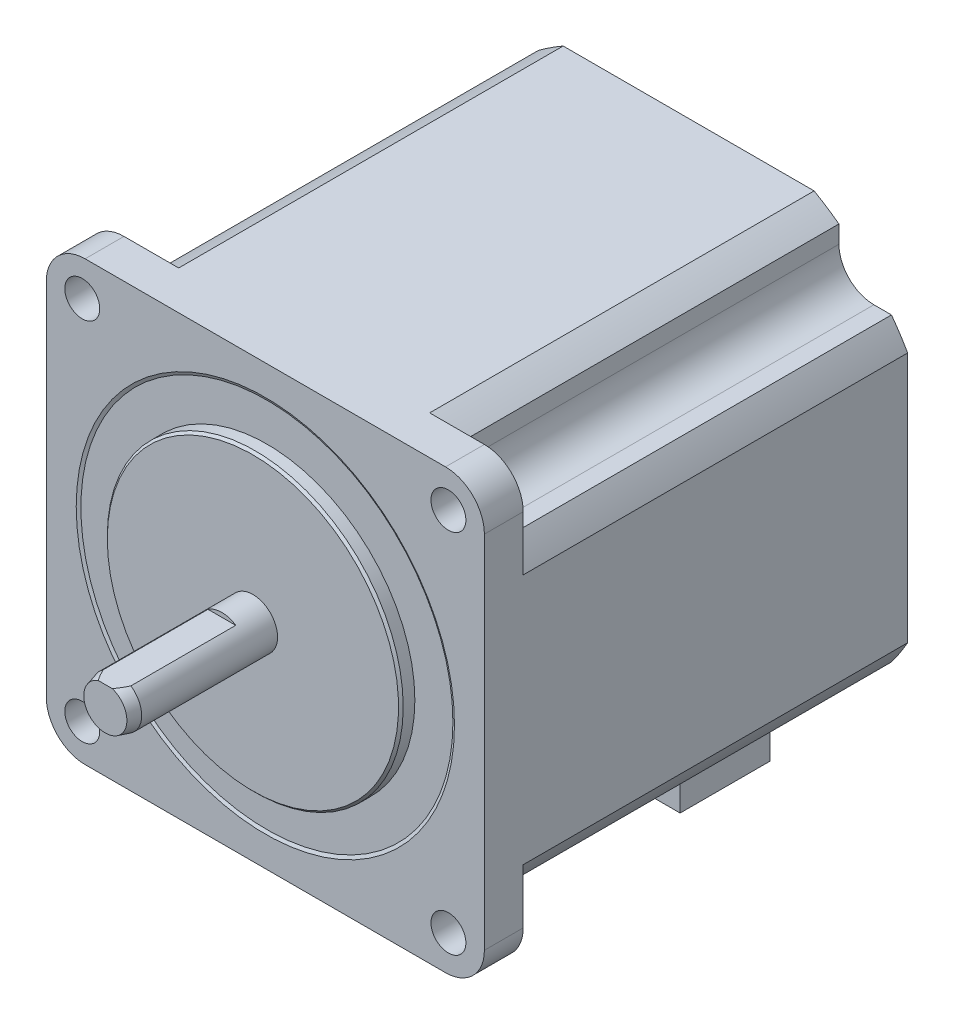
SolidWorks part; units mm, degrees
ref_plane "正面" through (0, 0, 0) normal (0, 0, 1) x (1, 0, 0)
ref_plane "平面" through (0, 0, 0) normal (0, 1, 0) x (1, 0, 0)
ref_plane "右側面" through (0, 0, 0) normal (1, 0, 0) x (0, 0, -1)
sketch "ｽｹｯﾁ1" plane through (0, 0, 0) normal (0, 0, 1) x (1, 0, 0)
  circle A0 centre (0, 0) radius 3.175
  dimension "D1" = 6.35
extrude "押し出し1" add sketch "ｽｹｯﾁ1" along normal blind 19
sketch "ｽｹｯﾁ2" plane through (0, 0, 0) normal (0, 0, -1) x (-1, 0, 0)
  circle A0 centre (0, 0) radius 19.05
  dimension "D1" = 38.1
extrude "押し出し2" add sketch "ｽｹｯﾁ2" along normal blind 1.6
sketch "ｽｹｯﾁ3" plane through (0, 0, -1.6) normal (0, 0, -1) x (-1, 0, 0)
  line L1 (-28.2, 28.2) -> (28.2, 28.2)
  line L2 (-28.2, 28.2) -> (-28.2, -28.2)
  line L3 (-28.2, -28.2) -> (28.2, -28.2)
  line L4 (28.2, 28.2) -> (28.2, -28.2)
  line L5 (-28.2, 28.2) -> (28.2, -28.2) construction
  line L6 (-28.2, -28.2) -> (28.2, 28.2) construction
  line L7 (23.57, 23.57) -> (-23.57, 23.57) construction
  line L8 (23.57, 23.57) -> (23.57, -23.57) construction
  line L9 (23.57, -23.57) -> (-23.57, -23.57) construction
  line L10 (-23.57, 23.57) -> (-23.57, -23.57) construction
  line L11 (23.57, 23.57) -> (-23.57, -23.57) construction
  line L12 (23.57, -23.57) -> (-23.57, 23.57) construction
  circle A0 centre (23.57, 23.57) radius 2.25
  circle A1 centre (-23.57, 23.57) radius 2.25
  circle A2 centre (23.57, -23.57) radius 2.25
  circle A3 centre (-23.57, -23.57) radius 2.25
  point P0 (0, 0)
  point P6 (0, 0)
  dimension "D3" = 47.14
  dimension "D4" = 47.14
  dimension "D6" = 4.5
  dimension "D1" = 56.4
  dimension "D2" = 56.4
extrude "押し出し3" add sketch "ｽｹｯﾁ3" along normal blind 5
fillet "Fillet1" radius 5 4 edges at (28.2, -28.2, -4.1) (-28.2, -28.2, -4.1) (-28.2, 28.2, -4.1) (28.2, 28.2, -4.1)
sketch "ｽｹｯﾁ4" plane through (0, 0, -6.6) normal (0, 0, -1) x (-1, 0, 0)
  line L0 (19.35, 19.35) -> (28.2, 19.35)
  line L1 (-19.35, 28.2) -> (19.35, 28.2)
  line L2 (-19.35, 28.2) -> (-19.35, 19.35)
  line L3 (-19.35, -28.2) -> (19.35, -28.2)
  line L4 (19.35, 28.2) -> (19.35, 19.35)
  line L5 (-19.35, 28.2) -> (19.35, -28.2) construction
  line L6 (-19.35, -28.2) -> (19.35, 28.2) construction
  line L7 (-28.2, 19.35) -> (-19.35, 19.35)
  line L8 (-28.2, 19.35) -> (-28.2, -19.35)
  line L9 (-28.2, -19.35) -> (-19.35, -19.35)
  line L10 (28.2, 19.35) -> (28.2, -19.35)
  line L11 (-28.2, 19.35) -> (28.2, -19.35) construction
  line L12 (-28.2, -19.35) -> (28.2, 19.35) construction
  line L13 (-19.35, -19.35) -> (-19.35, -28.2)
  line L14 (19.35, -19.35) -> (28.2, -19.35)
  line L15 (19.35, -19.35) -> (19.35, -28.2)
  circle A0 centre (0, 0) radius 32.5
  point P0 (0, 0)
  point P6 (0, 0)
  dimension "D5" = 65
  dimension "D1" = 38.7
  dimension "D2" = 56.4
  dimension "D3" = 56.4
  dimension "D4" = 38.7
extrude "押し出し4" add sketch "ｽｹｯﾁ4" along normal blind 49.5 contours L10 A0 L0 L4 L1 L2 L7 L8 L9 L13 L3 L15 L14
fillet "Fillet2" radius 4.5 4 edges at (19.35, -19.35, -31.35) (-19.35, -19.35, -31.35) (-19.35, 19.35, -31.35) (19.35, 19.35, -31.35)
sketch "Sketch1" plane through (0, -28.2, 0) normal (0, -1, 0) x (1, 0, 0)
  line L0 (16.1558, -56.1) -> (-16.1558, -56.1) construction
  line L1 (-10.5, -56.1) -> (10.5, -56.1)
  line L2 (-10.5, -56.1) -> (-10.5, -44.5)
  line L3 (-10.5, -44.5) -> (10.5, -44.5)
  line L4 (10.5, -56.1) -> (10.5, -44.5)
  dimension "D1" = 11.6
  dimension "D2" = 21
  dimension "D3" = 10.5
extrude "Extrude1" add sketch "Sketch1" along normal blind 10
chamfer "Chamfer5" distance 1.5 angle 15 1 edges at (3.175, 0, 19)
sketch "Sketch2" plane through (0, 0, 19) normal (0, 0, 1) x (1, 0, 0)
  line L1 (-4.7278, 5.1185) -> (3.4221, 5.1185)
  line L2 (-4.7278, 5.1185) -> (-4.7278, 2.625)
  line L3 (-4.7278, 2.625) -> (3.4221, 2.625)
  line L4 (3.4221, 5.1185) -> (3.4221, 2.625)
  dimension "D1" = 2.625
extrude "Extrude2" cut sketch "Sketch2" against normal blind 15
sketch "Sketch6" plane through (0, 0, -1.6) normal (0, 0, 1) x (1, 0, 0)
  circle A0 centre (0, 0) radius 19.05
  circle A1 centre (0, 0) radius 24.35
  dimension "D1" = 48.7
  dimension "D2" = 38.1
extrude "Extrude6" cut sketch "Sketch6" against normal blind 0.2
chamfer "Chamfer6" distance 0.2 distance2 0.4 1 edges at (24.35, 0, -1.8)
chamfer "Chamfer2" distance 0.3 angle 45 1 edges at (-19.05, 0, 0)
sketch "Sketch4" plane through (0, 0, -56.1) normal (0, 0, -1) x (-1, 0, 0)
  circle A0 centre (0, 0) radius 3.175
  dimension "D1" = 6.35
extrude "Extrude4" add sketch "Sketch4" along normal blind 16
sketch "Sketch5" plane through (0, 0, -72.1) normal (0, 0, -1) x (-1, 0, 0)
  line L1 (-2.9986, 5.5143) -> (3.3195, 5.5143)
  line L2 (-2.9986, 5.5143) -> (-2.9986, 2.625)
  line L3 (-2.9986, 2.625) -> (3.3195, 2.625)
  line L4 (3.3195, 5.5143) -> (3.3195, 2.625)
  dimension "D2" = 2.625
extrude "Extrude5" cut sketch "Sketch5" against normal blind 15
chamfer "Chamfer4" distance 1.5 angle 15 1 edges at (0, -3.175, -72.1)
